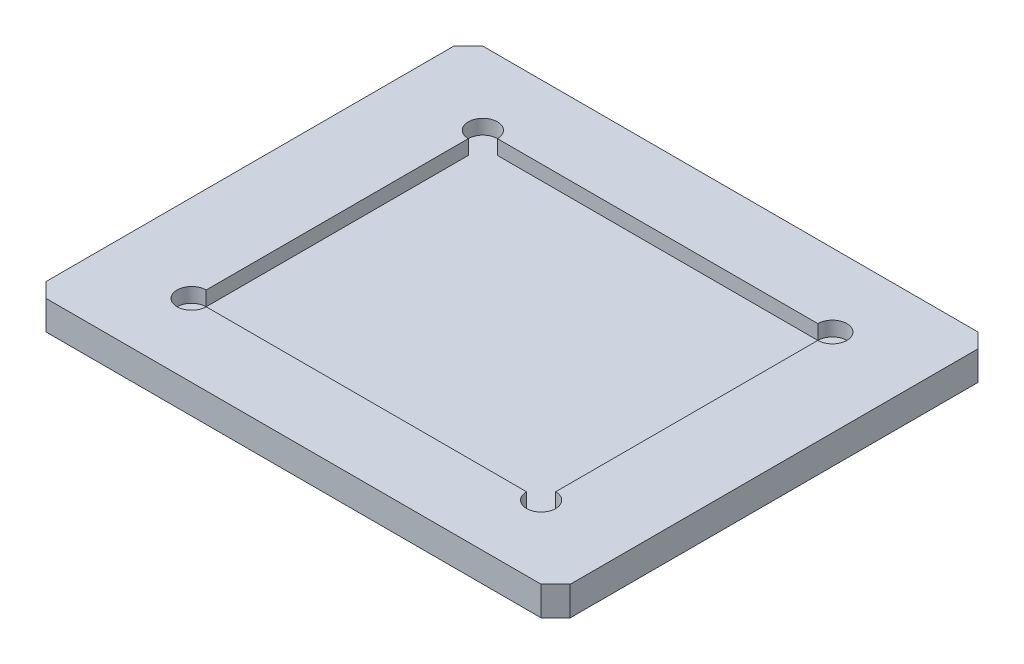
SolidWorks part; units mm, degrees
ref_plane "正面" through (0, 0, 0) normal (0, 0, 1) x (1, 0, 0)
ref_plane "平面" through (0, 0, 0) normal (0, 1, 0) x (1, 0, 0)
ref_plane "右側面" through (0, 0, 0) normal (1, 0, 0) x (0, 0, -1)
ref_plane "平面1" through (0, 10, 0) normal (0, 1, 0) x (1, 0, 0)
sketch "ｽｹｯﾁ1" plane through (0, 10, 0) normal (0, 1, 0) x (1, 0, 0)
  line L0 (90, 75) -> (-90, 75)
  line L1 (-90, 75) -> (-90, -75)
  line L2 (-90, -75) -> (90, -75)
  line L3 (90, -75) -> (90, 75)
  line L4 (0, 75) -> (0, 0) construction
  line L5 (0, 0) -> (90, 0) construction
  dimension "D1" = 180
  dimension "D2" = 150
extrude "ﾎﾞｽ - 押し出し1" add sketch "ｽｹｯﾁ1" against normal blind 10
sketch "ｽｹｯﾁ2" plane through (0, 10, 0) normal (0, 1, 0) x (-1, 0, 0)
  line L0 (60, -50) -> (60, 50)
  line L1 (60, 50) -> (-60, 50)
  line L2 (-60, 50) -> (-60, -50)
  line L3 (-60, -50) -> (60, -50)
  line L4 (0, 50) -> (0, 0) construction
  line L5 (0, 0) -> (60, 0) construction
  dimension "D1" = 120
  dimension "D2" = 100
extrude "ｶｯﾄ - 押し出し1" cut sketch "ｽｹｯﾁ2" against normal blind 5
sketch "ｽｹｯﾁ3" plane through (0, 10, 0) normal (0, 1, 0) x (1, 0, 0)
  line L0 (-60, 50) -> (-60, -50) construction
  line L1 (-60, -50) -> (60, -50) construction
  line L2 (-60, -50) -> (60, -50) construction
  circle A0 centre (-60, 50) radius 5
  circle A1 centre (60, 50) radius 5
  circle A2 centre (60, -50) radius 5
  circle A3 centre (-60, -50) radius 5
  point P10 (-75, 55)
  point P12 (75, 55)
  point P14 (75, -55)
  point P16 (-75, -55)
  point P17 (0, 0)
  point P18 (-60, -50)
  dimension "D1" = 10
  dimension "D2" = 10
  dimension "D3" = 10
  dimension "D4" = 10
extrude "ｶｯﾄ - 押し出し2" cut sketch "ｽｹｯﾁ3" against normal up to surface (5 mm away) contours A1 M6 M5 | A2 M7 M6 | A3 M8 M7 | A0 M5 M8
chamfer "面取り1" distance 5 angle 45 4 edges at (90, 5, -75) (-90, 5, -75) (90, 5, 75) (-90, 5, 75)
